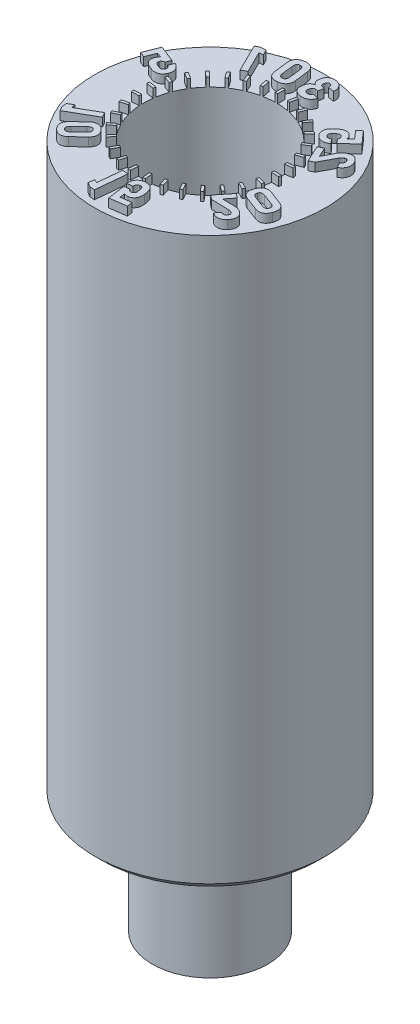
SolidWorks part; units mm, degrees
other "<M4L10-SetScrew>-<Chamfer1>" parameters "D10"=0.24
ref_plane "Front Plane" through (0, 0, 0) normal (0, 0, 1) x (1, 0, 0)
ref_plane "Top Plane" through (0, 0, 0) normal (0, 1, 0) x (1, 0, 0)
ref_plane "Right Plane" through (0, 0, 0) normal (1, 0, 0) x (0, 0, -1)
sketch "Sketch1" plane through (0, 0, 0) normal (0, 0, 1) x (1, 0, 0)
  line L0 (0, 0) -> (0, 20) construction
  line L1 (0, -11) -> (0, 11) construction
  line L2 (2, -19.7) -> (3.76, -19.7)
  line L4 (4, -19.46) -> (4, 0)
  line L5 (4, 0) -> (2.3, 0)
  line L6 (2.3, 0) -> (2.3, -4)
  line L7 (2.3, -4) -> (1.25, -4)
  line L8 (1.25, -4) -> (1.25, -13.7)
  line L9 (1.25, -13.7) -> (2, -13.7)
  line L10 (2, -13.7) -> (2, -19.7)
  line L11 (3.76, -19.7) -> (4, -19.46)
  point P6 (4, -19.7)
  dimension "D1" = 4
  dimension "D2" = 6
  dimension "D3" = 2.5
  dimension "D4" = 4.6
  dimension "D5" = 8
  dimension "D6" = 4
  dimension "D7" = 19.7
revolve "Revolve1" add sketch "Sketch1" angle 360 about L0
sketch "Sketch2" plane through (0, 0, 0) normal (0, 1, 0) x (1, 0, 0)
  line L0 (0, 0) -> (0, 4.1718) construction
  line L1 (0.4712, 2.5162) -> (0.5593, 2.4981)
  line L2 (-0.045, 2.5596) -> (0.045, 2.5596)
  line L3 (-0.045, 2.5596) -> (-0.045, 2.2996)
  line L4 (0.5593, 2.4981) -> (0.507, 2.2434)
  line L5 (0.045, 2.5596) -> (0.045, 2.2996)
  line L6 (0.4712, 2.5162) -> (0.4188, 2.2615)
  line L7 (0.968, 2.3699) -> (1.0507, 2.3344)
  line L8 (1.0507, 2.3344) -> (0.9482, 2.0955)
  line L9 (0.968, 2.3699) -> (0.8655, 2.1309)
  line L10 (1.4253, 2.1265) -> (1.4991, 2.0751)
  line L11 (1.4991, 2.0751) -> (1.3506, 1.8617)
  line L12 (1.4253, 2.1265) -> (1.2767, 1.9131)
  line L13 (1.8241, 1.7961) -> (1.8862, 1.7308)
  line L14 (1.8862, 1.7308) -> (1.6977, 1.5517)
  line L15 (1.8241, 1.7961) -> (1.6357, 1.6169)
  line L16 (2.1484, 1.3921) -> (2.196, 1.3157)
  line L17 (2.196, 1.3157) -> (1.9753, 1.1782)
  line L18 (2.1484, 1.3921) -> (1.9277, 1.2546)
  line L19 (2.3846, 0.9311) -> (2.4159, 0.8467)
  line L20 (2.4159, 0.8467) -> (2.172, 0.7565)
  line L21 (2.3846, 0.9311) -> (2.1408, 0.8408)
  line L22 (2.5232, 0.4321) -> (2.5369, 0.3431)
  line L23 (2.5369, 0.3431) -> (2.2799, 0.3037)
  line L24 (2.5232, 0.4321) -> (2.2662, 0.3927)
  line L25 (2.5586, -0.0847) -> (2.554, -0.1746)
  line L26 (2.554, -0.1746) -> (2.2943, -0.1614)
  line L27 (2.5586, -0.0847) -> (2.2989, -0.0715)
  line L28 (2.4891, -0.598) -> (2.4666, -0.6851)
  line L29 (2.4666, -0.6851) -> (2.2149, -0.62)
  line L30 (2.4891, -0.598) -> (2.2374, -0.5328)
  line L31 (2.3178, -1.0868) -> (2.2782, -1.1676)
  line L32 (2.2782, -1.1676) -> (2.0447, -1.0531)
  line L33 (2.3178, -1.0868) -> (2.0844, -0.9723)
  line L34 (2.0516, -1.5311) -> (1.9965, -1.6023)
  line L35 (1.9965, -1.6023) -> (1.7909, -1.4432)
  line L36 (2.0516, -1.5311) -> (1.846, -1.372)
  line L37 (1.7014, -1.9128) -> (1.6331, -1.9714)
  line L38 (1.6331, -1.9714) -> (1.4637, -1.7741)
  line L39 (1.7014, -1.9128) -> (1.532, -1.7155)
  line L40 (1.2815, -2.2161) -> (1.2028, -2.2598)
  line L41 (1.2028, -2.2598) -> (1.0766, -2.0325)
  line L42 (1.2815, -2.2161) -> (1.1553, -1.9888)
  line L43 (0.8092, -2.4287) -> (0.7233, -2.4556)
  line L44 (0.7233, -2.4556) -> (0.6455, -2.2076)
  line L45 (0.8092, -2.4287) -> (0.7313, -2.1806)
  line L46 (0.3037, -2.5419) -> (0.2142, -2.551)
  line L47 (0.2142, -2.551) -> (0.1879, -2.2923)
  line L48 (0.3037, -2.5419) -> (0.2774, -2.2832)
  line L49 (-0.2142, -2.551) -> (-0.3037, -2.5419)
  line L50 (-0.3037, -2.5419) -> (-0.2774, -2.2832)
  line L51 (-0.2142, -2.551) -> (-0.1879, -2.2923)
  line L52 (-0.7233, -2.4556) -> (-0.8092, -2.4287)
  line L53 (-0.8092, -2.4287) -> (-0.7313, -2.1806)
  line L54 (-0.7233, -2.4556) -> (-0.6455, -2.2076)
  line L55 (-1.2028, -2.2598) -> (-1.2815, -2.2161)
  line L56 (-1.2815, -2.2161) -> (-1.1553, -1.9888)
  line L57 (-1.2028, -2.2598) -> (-1.0766, -2.0325)
  line L58 (-1.6331, -1.9714) -> (-1.7014, -1.9128)
  line L59 (-1.7014, -1.9128) -> (-1.532, -1.7155)
  line L60 (-1.6331, -1.9714) -> (-1.4637, -1.7741)
  line L61 (-1.9965, -1.6023) -> (-2.0516, -1.5311)
  line L62 (-2.0516, -1.5311) -> (-1.846, -1.372)
  line L63 (-1.9965, -1.6023) -> (-1.7909, -1.4432)
  line L64 (-2.2782, -1.1676) -> (-2.3178, -1.0868)
  line L65 (-2.3178, -1.0868) -> (-2.0844, -0.9723)
  line L66 (-2.2782, -1.1676) -> (-2.0447, -1.0531)
  line L67 (-2.4666, -0.6851) -> (-2.4891, -0.598)
  line L68 (-2.4891, -0.598) -> (-2.2374, -0.5328)
  line L69 (-2.4666, -0.6851) -> (-2.2149, -0.62)
  line L70 (-2.554, -0.1746) -> (-2.5586, -0.0847)
  line L71 (-2.5586, -0.0847) -> (-2.2989, -0.0715)
  line L72 (-2.554, -0.1746) -> (-2.2943, -0.1614)
  line L73 (-2.5369, 0.3431) -> (-2.5232, 0.4321)
  line L74 (-2.5232, 0.4321) -> (-2.2662, 0.3927)
  line L75 (-2.5369, 0.3431) -> (-2.2799, 0.3037)
  line L76 (-2.4159, 0.8467) -> (-2.3846, 0.9311)
  line L77 (-2.3846, 0.9311) -> (-2.1408, 0.8408)
  line L78 (-2.4159, 0.8467) -> (-2.172, 0.7565)
  line L79 (-2.196, 1.3157) -> (-2.1484, 1.3921)
  line L80 (-2.1484, 1.3921) -> (-1.9277, 1.2546)
  line L81 (-2.196, 1.3157) -> (-1.9753, 1.1782)
  line L82 (-1.8862, 1.7308) -> (-1.8241, 1.7961)
  line L83 (-1.8241, 1.7961) -> (-1.6357, 1.6169)
  line L84 (-1.8862, 1.7308) -> (-1.6977, 1.5517)
  line L85 (-1.4991, 2.0751) -> (-1.4253, 2.1265)
  line L86 (-1.4253, 2.1265) -> (-1.2767, 1.9131)
  line L87 (-1.4991, 2.0751) -> (-1.3506, 1.8617)
  line L88 (-1.0507, 2.3344) -> (-0.968, 2.3699)
  line L89 (-0.968, 2.3699) -> (-0.8655, 2.1309)
  line L90 (-1.0507, 2.3344) -> (-0.9482, 2.0955)
  line L91 (-0.5593, 2.4981) -> (-0.4712, 2.5162)
  line L92 (-0.4712, 2.5162) -> (-0.4188, 2.2615)
  line L93 (-0.5593, 2.4981) -> (-0.507, 2.2434)
  line L94 (0, 0) -> (3.6129, 2.0859) construction
  line L95 (0, 0) -> (3.6129, -2.0859) construction
  line L96 (0, 0) -> (0, -4.1718) construction
  line L97 (0, 0) -> (-3.6129, -2.0859) construction
  line L98 (0, 0) -> (-3.6129, 2.0859) construction
  circle A0 centre (0, 0) radius 2.715 construction
  arc A1 (0.045, 2.2996) -> (-0.045, 2.2996) centre (0, 0) ccw
  arc A2 (0.507, 2.2434) -> (0.4188, 2.2615) centre (0, 0) ccw
  arc A3 (0.9482, 2.0955) -> (0.8655, 2.1309) centre (0, 0) ccw
  arc A4 (1.3506, 1.8617) -> (1.2767, 1.9131) centre (0, 0) ccw
  arc A5 (1.6977, 1.5517) -> (1.6357, 1.6169) centre (0, 0) ccw
  arc A6 (1.9753, 1.1782) -> (1.9277, 1.2546) centre (0, 0) ccw
  arc A7 (2.172, 0.7565) -> (2.1408, 0.8408) centre (0, 0) ccw
  arc A8 (2.2799, 0.3037) -> (2.2662, 0.3927) centre (0, 0) ccw
  arc A9 (2.2943, -0.1614) -> (2.2989, -0.0715) centre (0, 0) ccw
  arc A10 (2.2149, -0.62) -> (2.2374, -0.5328) centre (0, 0) ccw
  arc A11 (2.0447, -1.0531) -> (2.0844, -0.9723) centre (0, 0) ccw
  arc A12 (1.7909, -1.4432) -> (1.846, -1.372) centre (0, 0) ccw
  arc A13 (1.4637, -1.7741) -> (1.532, -1.7155) centre (0, 0) ccw
  arc A14 (1.0766, -2.0325) -> (1.1553, -1.9888) centre (0, 0) ccw
  arc A15 (0.6455, -2.2076) -> (0.7313, -2.1806) centre (0, 0) ccw
  arc A16 (0.1879, -2.2923) -> (0.2774, -2.2832) centre (0, 0) ccw
  arc A17 (-0.2774, -2.2832) -> (-0.1879, -2.2923) centre (0, 0) ccw
  arc A18 (-0.7313, -2.1806) -> (-0.6455, -2.2076) centre (0, 0) ccw
  arc A19 (-1.1553, -1.9888) -> (-1.0766, -2.0325) centre (0, 0) ccw
  arc A20 (-1.532, -1.7155) -> (-1.4637, -1.7741) centre (0, 0) ccw
  arc A21 (-1.846, -1.372) -> (-1.7909, -1.4432) centre (0, 0) ccw
  arc A22 (-2.0844, -0.9723) -> (-2.0447, -1.0531) centre (0, 0) ccw
  arc A23 (-2.2374, -0.5328) -> (-2.2149, -0.62) centre (0, 0) ccw
  arc A24 (-2.2989, -0.0715) -> (-2.2943, -0.1614) centre (0, 0) ccw
  arc A25 (-2.2662, 0.3927) -> (-2.2799, 0.3037) centre (0, 0) ccw
  arc A26 (-2.1408, 0.8408) -> (-2.172, 0.7565) centre (0, 0) ccw
  arc A27 (-1.9277, 1.2546) -> (-1.9753, 1.1782) centre (0, 0) ccw
  arc A28 (-1.6357, 1.6169) -> (-1.6977, 1.5517) centre (0, 0) ccw
  arc A29 (-1.2767, 1.9131) -> (-1.3506, 1.8617) centre (0, 0) ccw
  arc A30 (-0.8655, 2.1309) -> (-0.9482, 2.0955) centre (0, 0) ccw
  arc A31 (-0.4188, 2.2615) -> (-0.507, 2.2434) centre (0, 0) ccw
  text T0 "   25    30 1     5       10     15     20" font "Bahnschrift" height 1.07
  point P17 (0, 0)
  point P132 (0, 0)
  point P138 (0, 0)
  dimension "D1" = 5.43
  dimension "D4" = 2.3
  dimension "D2" = 0.09
  dimension "D3" = 0.045
  dimension "D5" = 0.26
  dimension "D6" = 31
  dimension "D7" = 6
extrude "Boss-Extrude1" add sketch "Sketch2" along normal blind 0.3
inserted part "M4L10-SetScrew"
move or copy body "Body-Move/Copy2" placed by mates yes
other "Distance1" parameters "D1"=4
